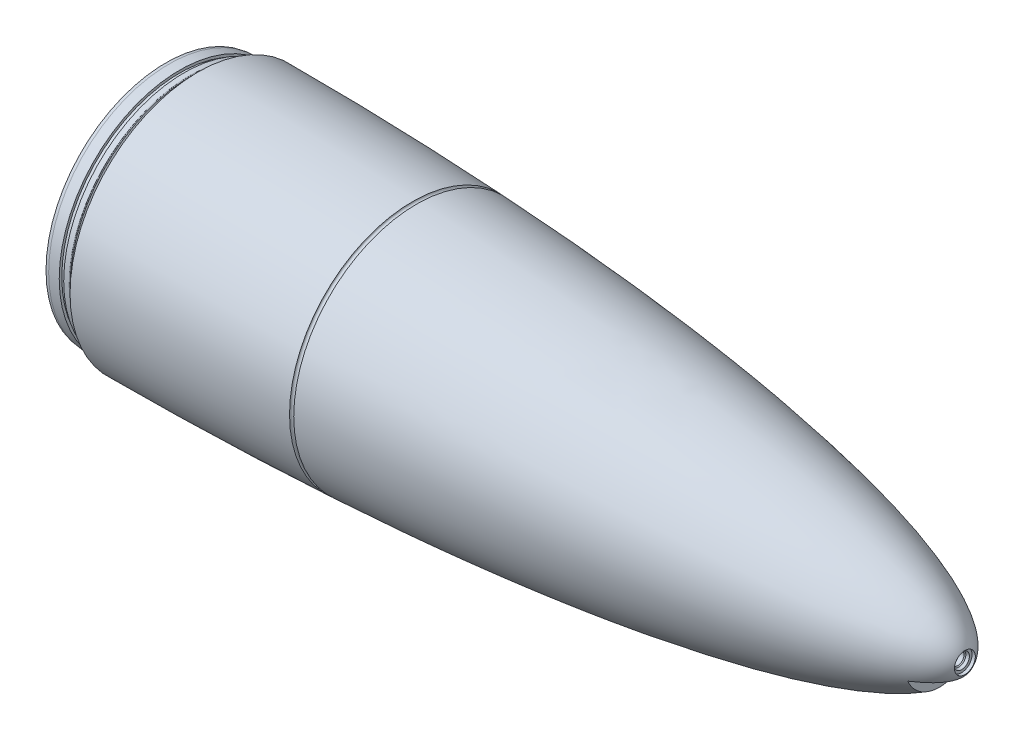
SolidWorks part; units mm, degrees
other "<GPC-3020Z_ZCam_NOSE>-<Chamfer2>"
ref_plane "Plane1" through (0, 0, 0) normal (0, 0, 1) x (1, 0, 0)
ref_plane "Plane2" through (0, 0, 0) normal (0, 1, 0) x (1, 0, 0)
ref_plane "Plane3" through (0, 0, 0) normal (1, 0, 0) x (0, 0, -1)
inserted part "GPC-3020Z_ZCam_NOSE"
sketch "Sketch3" plane through (-25.4, 0, 0) normal (-1, 0, 0) x (0, 0, 1)
  circle A0 centre (0, 91.44) radius 1.7272
  circle A1 centre (64.6578, 64.6578) radius 1.7272
  circle A2 centre (91.44, 0) radius 1.7272
  circle A3 centre (64.6578, -64.6578) radius 1.7272
  circle A4 centre (0, -91.44) radius 1.7272
  circle A5 centre (-64.6578, -64.6578) radius 1.7272
  circle A6 centre (-91.44, 0) radius 1.7272
  circle A7 centre (-64.6578, 64.6578) radius 1.7272
  dimension "D1" = 3.4544
  dimension "D2" = 91.44
extrude "aft_bolt_circle" cut sketch "Sketch3" against normal blind 6.35
sketch "Sketch9" plane through (607.568, 0, 0) normal (1, 0, 0) x (0, 0, -1)
  circle A0 centre (0, 0) radius 8.255
  dimension "D1" = 16.51
extrude "boss_land" cut sketch "Sketch9" against normal blind 2.54
sketch "Sketch10" plane through (605.028, 0, 0) normal (1, 0, 0) x (0, 0, -1)
  circle A0 centre (0, 0) radius 4.953
  dimension "D1" = 9.906
extrude "cbore" cut sketch "Sketch10" against normal blind 20.32
sketch "Sketch11" plane through (584.708, 0, 0) normal (1, 0, 0) x (0, 0, -1)
  circle A0 centre (0, 0) radius 2.54
  dimension "D1" = 5.08
extrude "nose_thru" cut sketch "Sketch11" against normal up to next
sketch "Sketch12" plane through (605.028, 1.9584, -6.1724) normal (1, 0, 0) x (0, 0, -1)
  circle A0 centre (-6.1724, -1.9584) radius 4.9606
  dimension "D1" = 9.9212
extrude "Cut-Extrude12" cut sketch "Sketch12" against normal blind 10.16
sketch "Sketch13" plane through (605.028, 0, 0) normal (1, 0, 0) x (0, 0, -1)
  circle A0 centre (0, 0) radius 8.255
  dimension "D1" = 16.51
extrude "Cut-Extrude13" cut sketch "Sketch13" against normal blind 0.0508
sketch "Sketch14" plane through (604.9772, 0, 0) normal (1, 0, 0) x (0, 0, -1)
  circle A0 centre (0, 0) radius 6.1849
  dimension "D1" = 12.3698
extrude "Cut-Extrude14" cut sketch "Sketch14" against normal blind 2.3622 draft 12
sketch "Sketch15" plane through (602.615, 0, 0) normal (1, 0, 0) x (0, 0, -1)
  circle A0 centre (0, 0) radius 5.6828
  dimension "D1" = 11.3656
extrude "Cut-Extrude15" cut sketch "Sketch15" against normal blind 2.54 draft 45
other "boss_plug"
sketch "Sketch16" plane through (0, 0, 0) normal (0, 0, 1) x (1, 0, 0)
  line L0 (607.568, -8.268) -> (607.568, 8.268) construction
  line L1 (585.7685, 28.9015) -> (603.9675, 15.39) construction
  line L2 (594.868, 22.1457) -> (581.6838, 4.3875) construction
  line L3 (594.868, 22.1457) -> (593.3211, 23.2942)
  line L4 (593.3211, 23.2942) -> (586.4407, 14.0267)
  line L5 (586.4407, 14.0267) -> (587.2975, 11.9488)
  line L6 (587.2975, 11.9488) -> (594.868, 22.1457)
  ellipse E0 centre (0, 0) end of major axis (609.6, 0) minor radius 101.346 (607.568, 8.268) -> (0, 101.346) ccw construction
  point P0 (594.868, 22.1457)
  dimension "D1" = 12.7
  dimension "D2" = 59
  dimension "D3" = 12.7
  dimension "D4" = 3.8532
revolve "Cut-Revolve1" [suppressed] cut sketch "Sketch16" angle 360 about L2
pattern_circular "CirPattern1" [suppressed] count 4 over 360
sketch "Sketch17" plane through (0, 0, 0) normal (0, 0, 1) x (1, 0, 0)
  line L0 (0, 101.346) -> (0, -101.346) construction
  line L1 (-183.1249, 0) -> (709.9751, 0) construction
  circle A0 centre (171.45, -97.2551) radius 1.5875
  ellipse E0 centre (0, 0) end of major axis (609.6, 0) minor radius 101.346 (0, -101.346) -> (607.568, -8.268) ccw construction
  dimension "D2" = 3.175
  dimension "D1" = 171.45
  dimension "D3" = 194.5102
revolve "Cut-Revolve2" cut sketch "Sketch17" angle 360 about L1
sketch "Sketch18" plane through (0, 0, 0) normal (0, 0, 1) x (1, 0, 0)
  line L0 (602.3944, 15.5363) -> (586.5194, 15.5363)
  line L1 (586.5194, 15.5363) -> (586.5194, 27.6231)
  line L2 (586.5194, 27.6231) -> (602.3944, 27.6231)
  line L3 (602.3944, 27.6231) -> (602.3944, 15.5363)
  line L4 (620.4807, 0) -> (548.9163, 0) construction
  ellipse E0 centre (0, 0) end of major axis (609.6, 0) minor radius 101.346 (607.568, 8.268) -> (173.0356, 97.1775) ccw construction
  ellipse E1 centre (0, 0) end of major axis (609.6, 0) minor radius 101.346 (607.568, 8.268) -> (173.0356, 97.1775) ccw construction
  dimension "D1" = 15.875
revolve "Cut-Revolve3" [suppressed] cut sketch "Sketch18" angle 360 about L4
sketch "Sketch19" plane through (0, 0, 0) normal (1, 0, 0) x (0, 0, -1)
  line L1 (0, 0) -> (231, 0)
  line L2 (0, 0) -> (0, 156.8824)
  line L3 (0, 156.8824) -> (231, 156.8824)
  line L4 (231, 0) -> (231, 156.8824)
extrude "Cut-Extrude16" [suppressed] cut sketch "Sketch19" against normal through all both and the other way through all flip side to cut
sketch "Sketch20" plane through (0, 0, 0) normal (0, 0, 1) x (1, 0, 0)
  line L0 (606.425, -10.3301) -> (587.375, -10.3301)
  line L1 (587.375, -10.3301) -> (587.375, -27.116)
  line L2 (587.375, -27.116) -> (606.425, -28.2699)
  line L3 (606.425, -28.2699) -> (606.425, -10.3301)
  line L4 (577.85, 26.3416) -> (577.85, -26.3416) construction
  ellipse E0 centre (0, 0) end of major axis (609.6, 0) minor radius 101.346 (173.0356, -97.1775) -> (607.568, -8.268) ccw construction
  ellipse E1 centre (0, 0) end of major axis (609.6, 0) minor radius 101.346 (173.0356, -97.1775) -> (607.568, -8.268) ccw construction
  dimension "D1" = 19.05
  dimension "D2" = 9.525
extrude "Cut-Extrude17" cut sketch "Sketch20" along normal through all both and the other way through all
sketch "Sketch21" plane through (0, -10.3301, 0) normal (0, -1, 0) x (1, 0, 0)
  line L0 (587.375, 0) -> (593.725, 0) construction
  line L1 (587.375, -25.0712) -> (587.375, 25.0712) construction
  line L2 (593.725, -12.7) -> (593.725, 12.7) construction
  circle A0 centre (593.725, 12.7) radius 2.0193
  circle A1 centre (593.725, -12.7) radius 2.0193
  dimension "D1" = 4.0386
  dimension "D2" = 6.35
  dimension "D3" = 25.4
extrude "Cut-Extrude18" cut sketch "Sketch21" against normal blind 19.05
sketch "Sketch22" plane through (0, 0, 0) normal (0, 0, 1) x (1, 0, 0)
  line L0 (215.2449, -95.2942) -> (331.4681, -85.8933) construction
  ellipse E0 centre (0, 0) end of major axis (609.6, 0) minor radius 101.346 (173.0356, -97.1775) -> (587.375, -27.116) ccw construction
  point P0 (266.7, -91.1322)
  dimension "D1" = 266.7
ref_plane "Plane4" through (9.057, -111.972, 0) normal (0.0806, -0.9967, 0) x (0.9967, 0.0806, 0)
sketch "Sketch23" plane through (9.057, -111.972, 0) normal (0.0806, -0.9967, 0) x (0.9967, 0.0806, 0)
  circle A0 centre (258.4845, 0) radius 12.7
  dimension "D1" = 25.4
extrude "Cut-Extrude19" [suppressed] cut sketch "Sketch23" against normal blind 1.27
sketch "Sketch24" [suppressed] plane through (9.057, -111.972, 0) normal (0.0806, -0.9967, 0) x (0.9967, 0.0806, 0)
  circle A0 centre (258.4845, 0) radius 5.5562
  dimension "D1" = 11.1125
extrude "Cut-Extrude20" [suppressed] cut sketch "Sketch24" against normal blind 101.6
